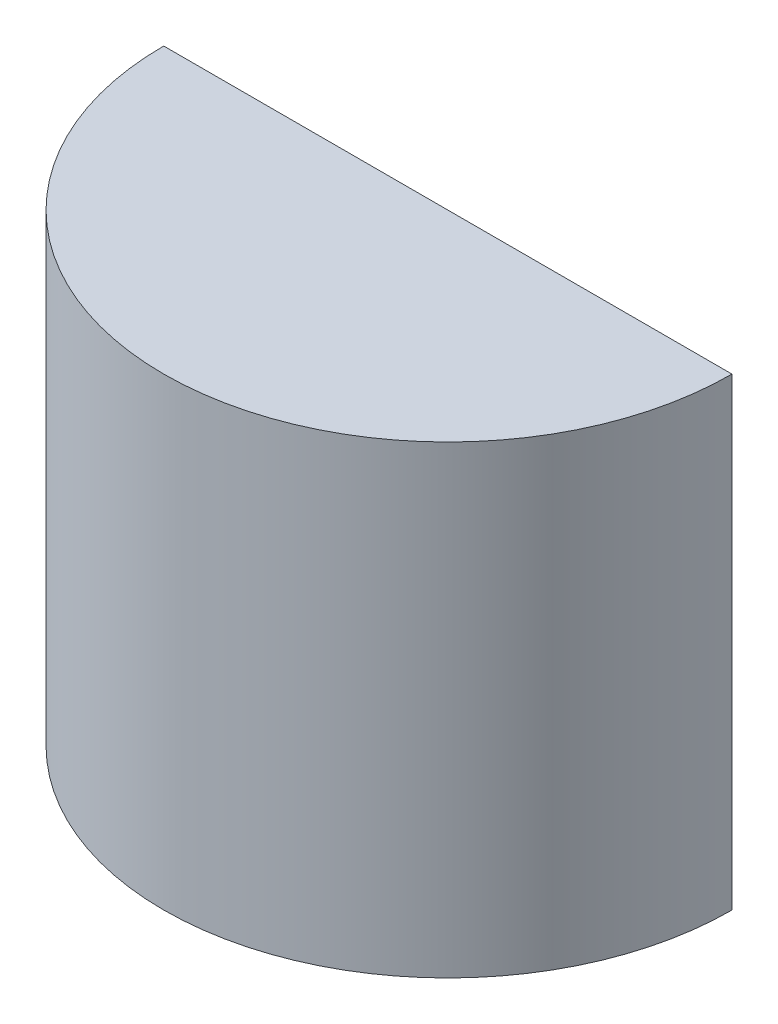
SolidWorks part; units mm, degrees
ref_plane "Спереди" through (0, 0, 0) normal (0, 0, 1) x (1, 0, 0)
ref_plane "Сверху" through (0, 0, 0) normal (0, 1, 0) x (1, 0, 0)
ref_plane "Справа" through (0, 0, 0) normal (1, 0, 0) x (0, 0, -1)
sketch "Эскиз1" plane through (0, 0, 0) normal (1, 0, 0) x (0, 0, -1)
  line L0 (-45.5, 65) -> (-50.5, 65)
  line L1 (0, 60) -> (0, 65)
  line L2 (-45.5, 0) -> (-42, 60)
  line L3 (-42, 60) -> (0, 60)
  line L4 (-50.5, 65) -> (-50.5, -17.5014)
  line L5 (-50.5, -17.5014) -> (-46.5209, -17.5014)
  line L7 (0, 0) -> (0, 60) construction
  line L9 (0, 65) -> (-45.5, 65)
  line L11 (-45.5, 0) -> (-46.5209, -17.5014)
  dimension "D1" = 60
  dimension "D2" = 45.5
  dimension "D5" = 42
revolve "Повернуть1" add sketch "Эскиз1" angle 360 about L7
sketch "Sketch1" plane through (0, 0, 0) normal (0, 0, 1) x (1, 0, 0)
  line L1 (-75.4746, 85.2112) -> (67.8634, 85.2112)
  line L2 (-75.4746, 85.2112) -> (-75.4746, -95.5755)
  line L3 (-75.4746, -95.5755) -> (67.8634, -95.5755)
  line L4 (67.8634, 85.2112) -> (67.8634, -95.5755)
ref_plane "Plane1" through (0, 0, 10) normal (0, 0, 1) x (1, 0, 0)
extrude "Cut-Extrude1" cut sketch "Sketch1" against normal through all
